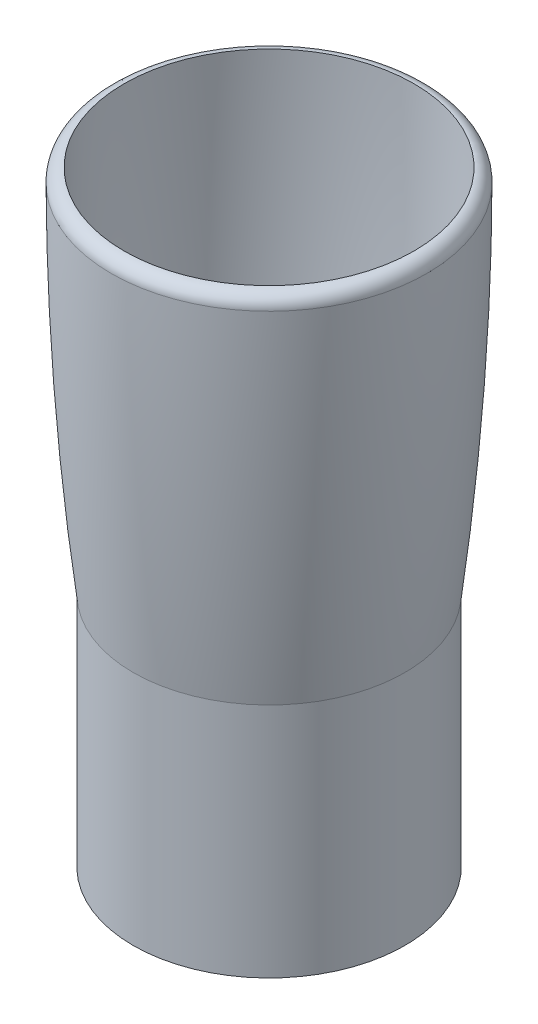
SolidWorks part; units mm, degrees
ref_plane "Front Plane" through (0, 0, 0) normal (0, 0, 1) x (1, 0, 0)
ref_plane "Top Plane" through (0, 0, 0) normal (0, 1, 0) x (1, 0, 0)
ref_plane "Right Plane" through (0, 0, 0) normal (1, 0, 0) x (0, 0, -1)
sketch "Sketch1" plane through (0, 0, 0) normal (0, 0, 1) x (1, 0, 0)
  line L3 (0, 0) -> (0, 174.5555) construction
  line L6 (31.0292, 59.7853) -> (31.0292, 0)
  arc A10 (31.0292, 59.7853) -> (36.5417, 152.7564) centre (-750.2251, 152.7564) ccw
  dimension "D3" = 786.7668
  dimension "D1" = 62.0584
  dimension "D6" = 152.7564
revolve "Revolve-Thin1" add sketch "Sketch1" angle 360 about L3
fillet "Fillet1" radius 3.3 1 edges at (0, 152.7564, -39.7677)
